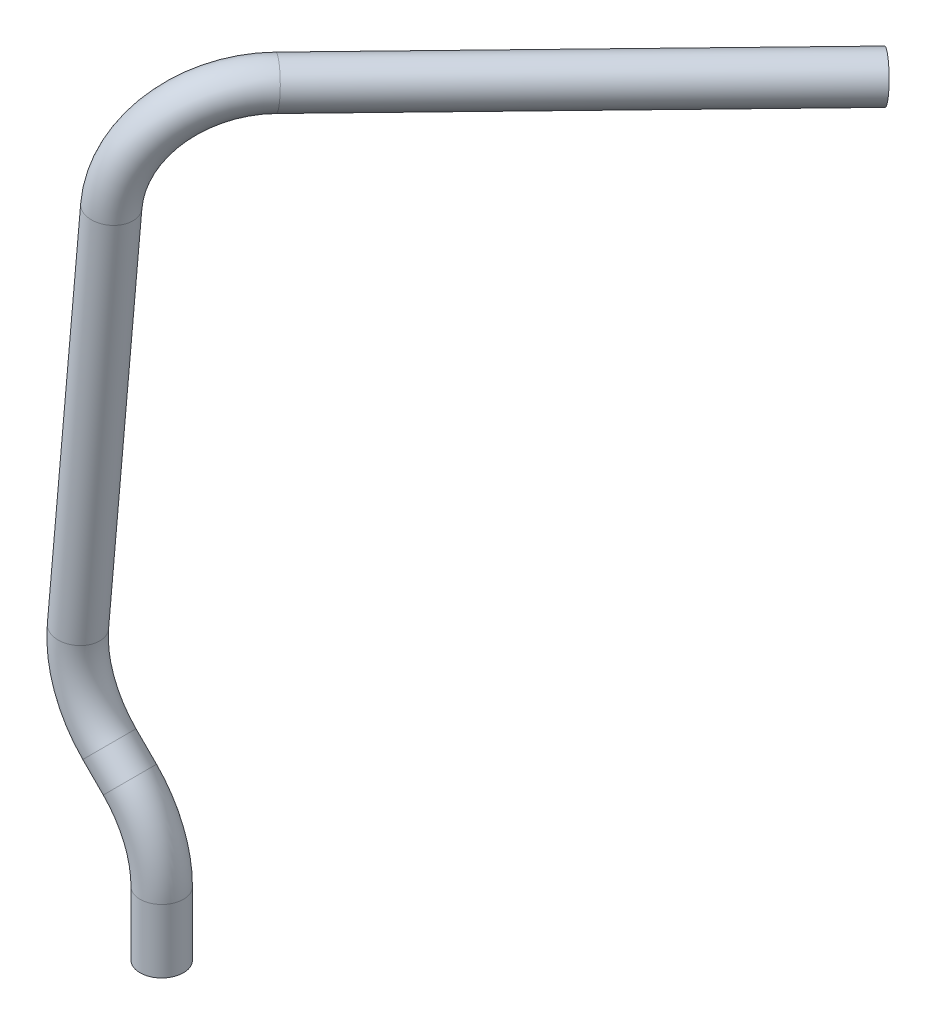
SolidWorks part; units mm, degrees
ref_plane "Front Plane" through (0, 0, 0) normal (0, 0, 1) x (1, 0, 0)
ref_plane "Top Plane" through (0, 0, 0) normal (0, 1, 0) x (1, 0, 0)
ref_plane "Right Plane" through (0, 0, 0) normal (1, 0, 0) x (0, 0, -1)
ref_plane "Plane1" through (39.9789, 155.8612, -36.8031) normal (0.1218, 0.9925, 0.004) x (0.0329, 0, -0.9995)
sketch3d "3DSketch1"
  line L0 (0, 0, 0) -> (0, 13.949, 0)
  line L1 (-6.9745, 30.787, 0) -> (-11.4646, 35.2771, 0)
  line L2 (-18.3486, 54.1905, 0) -> (-11.0554, 137.5522, 0)
  line L3 (5.9921, 159.9601, -19.0331) -> (64.6338, 153.066, -93.7738)
  line L5 (5.9921, 159.9601, -19.0331) -> (91.162, 159.9601, -19.0331) construction
  arc A0 (0, 13.949, 0) -> (-6.9745, 30.787, 0) centre (-23.8125, 13.949, 0) ccw
  arc A1 (-11.4646, 35.2771, 0) -> (-18.3486, 54.1905, 0) centre (5.3733, 52.1151, 0) ccw
  arc A2 (-11.0554, 137.5522, 0) -> (5.9921, 159.9601, -19.0331) centre (3.6459, 136.266, -18.6884) ccw
  point P7 (0, 23.8125, 0)
  point P8 (-23.8125, 13.949, 23.8125)
  point P11 (-19.05, 42.8625, 0)
  point P12 (5.3733, 52.1151, -23.8125)
  point P17 (-14.9714, 137.8948, -33.4457)
  point P18 (0, 0, 0)
  point P19 (0, 0, 0)
  dimension "D4" = 23.8125
  dimension "D5" = 23.8125
  dimension "D8" = 23.8125
  dimension "D1" = 23.8125
  dimension "D6" = 6.35
  dimension "D2" = 130
  dimension "D7" = 135
  dimension "D3" = 52
  dimension "D9" = 95.25
sketch "Sketch1" plane through (0, 0, 0) normal (0, 1, 0) x (1, 0, 0)
  circle A0 centre (0, 0) radius 4.7625
  circle A1 centre (0, 0) radius 3.8735
  dimension "D1" = 0.889
  dimension "D2" = 9.525
sweep "Sweep1" add profiles "Sketch1" path "3DSketch1"
